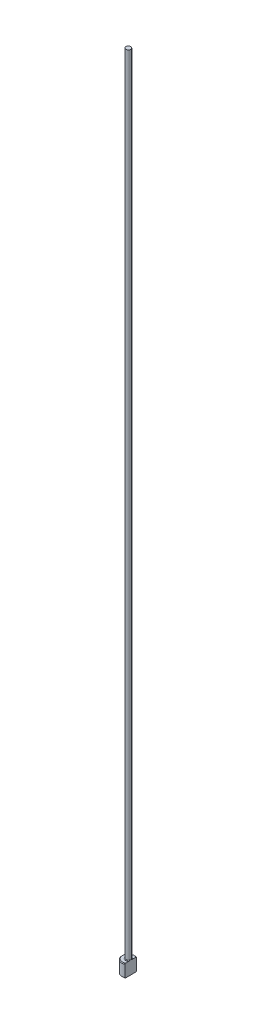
SolidWorks part; units mm, degrees
ref_plane "Front Plane" through (0, 0, 0) normal (0, 0, 1) x (1, 0, 0)
ref_plane "Top Plane" through (0, 0, 0) normal (0, 1, 0) x (1, 0, 0)
ref_plane "Right Plane" through (0, 0, 0) normal (1, 0, 0) x (0, 0, -1)
sketch "Sketch1" plane through (0, 0, 0) normal (0, 0, 1) x (1, 0, 0)
  line L0 (0, 259.9588) -> (0, -15.1925) construction
  line L1 (0, 0) -> (-2, 0)
  line L2 (-2, 0) -> (-2, 4)
  line L3 (-2, 4) -> (-0.75, 4)
  line L4 (-0.75, 4) -> (-0.75, 250)
  line L5 (-0.75, 250) -> (0, 250)
  line L6 (0, 250) -> (0, 0)
  dimension "L" = 250
  dimension "H" = 4
  dimension "T" = 4
  dimension "D" = 1.5
revolve "Revolve1" add sketch "Sketch1" angle 360 about L0
chamfer "Chamfer1" distance 0.2 angle 45 2 edges at (0, 4, 2) (0, 0, 2)
fillet "Fillet1" radius 0.2 1 edges at (0, 4, 0.75)
sketch "Sketch2" plane through (0, 0, 0) normal (0, 1, 0) x (1, 0, 0)
  line L0 (0.75, -1.854) -> (0.75, 1.854)
  circle A0 centre (0, 0) radius 2 construction
  arc A1 (0.75, -1.854) -> (0.75, 1.854) centre (0, 0) ccw
  circle A2 centre (0, 0) radius 0.75 construction
extrude "KEYED HEAD" cut sketch "Sketch2" along normal through all
